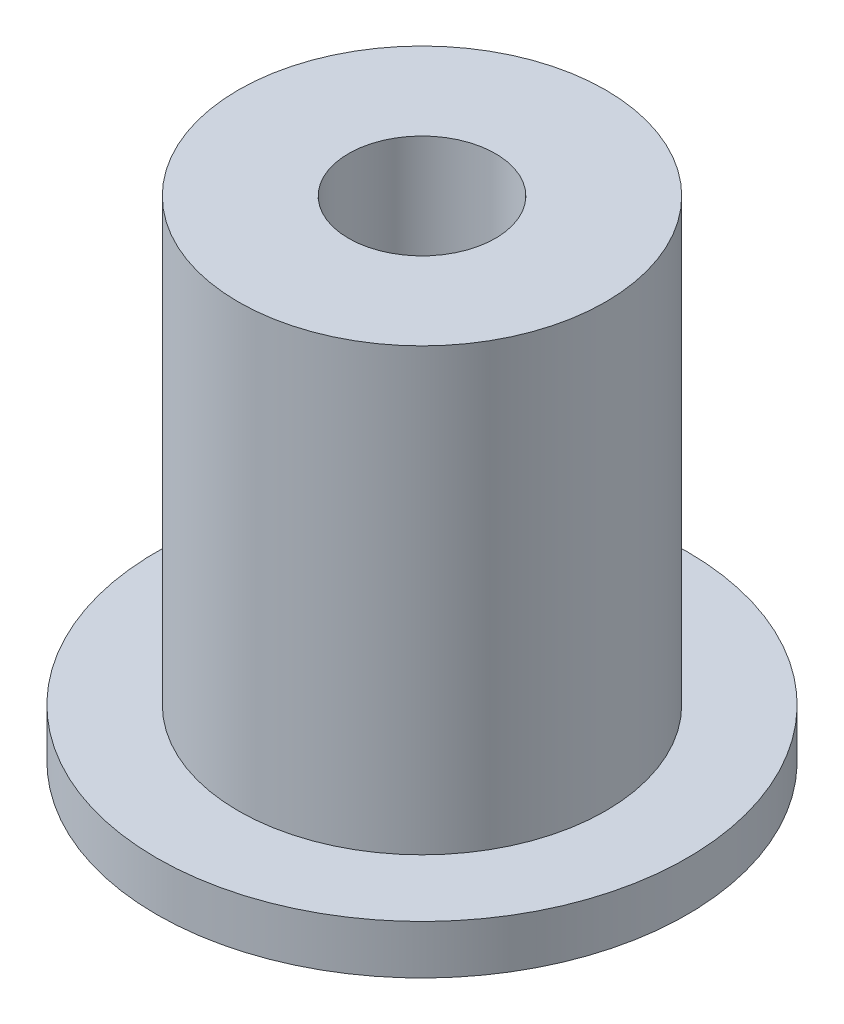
SolidWorks part; units mm, degrees
ref_plane "Front Plane" through (0, 0, 0) normal (0, 0, 1) x (1, 0, 0)
ref_plane "Top Plane" through (0, 0, 0) normal (0, 1, 0) x (1, 0, 0)
ref_plane "Right Plane" through (0, 0, 0) normal (1, 0, 0) x (0, 0, -1)
sketch "Sketch1" plane through (0, 0, 0) normal (0, 1, 0) x (1, 0, 0)
  circle A0 centre (0, 0) radius 32.5
  dimension "D1" = 65
extrude "Boss-Extrude1" add sketch "Sketch1" along normal blind 6
sketch "Sketch2" plane through (0, 6, 0) normal (0, 1, 0) x (1, 0, 0)
  circle A0 centre (0, 0) radius 22.5
  dimension "D1" = 45
extrude "Boss-Extrude3" add sketch "Sketch2" along normal blind 54
sketch "Sketch3" plane through (0, 60, 0) normal (0, 1, 0) x (1, 0, 0)
  circle A0 centre (0, 0) radius 9
  dimension "D1" = 18
extrude "Cut-Extrude1" cut sketch "Sketch3" against normal up to next
